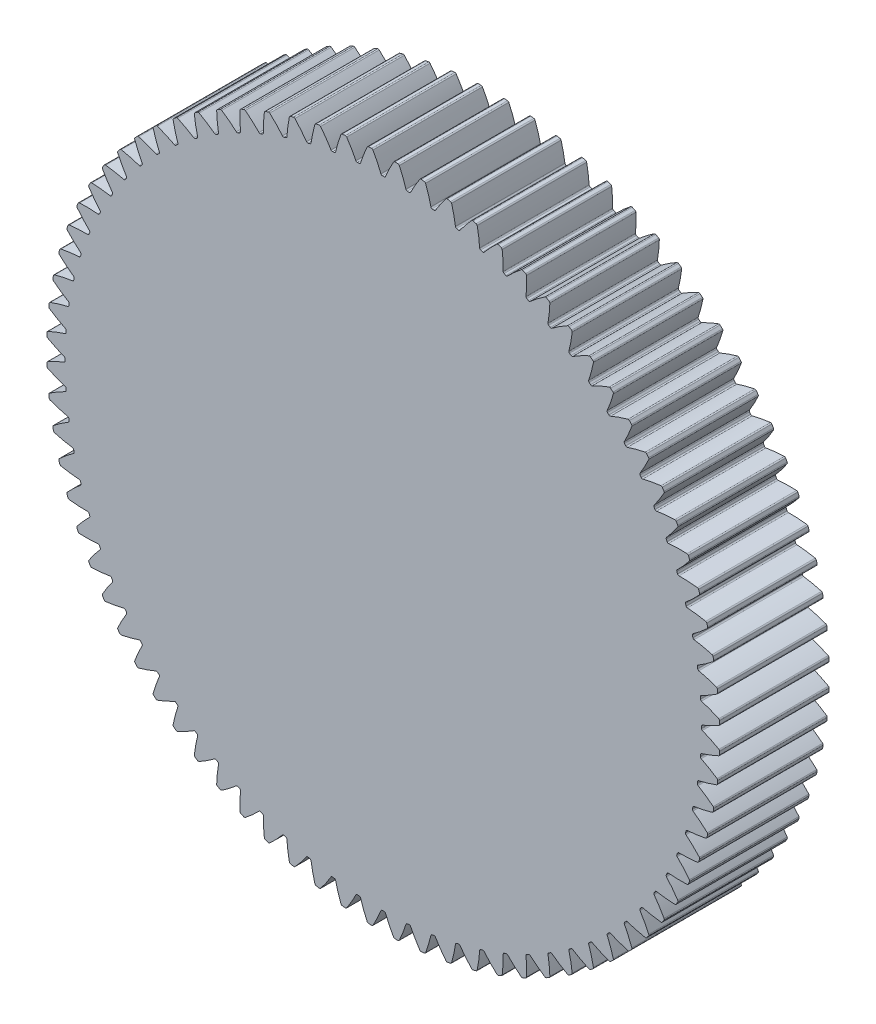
SolidWorks part; units mm, degrees
ref_plane "Front" through (0, 0, 0) normal (0, 0, 1) x (1, 0, 0)
ref_plane "Top" through (0, 0, 0) normal (0, 1, 0) x (1, 0, 0)
ref_plane "Right" through (0, 0, 0) normal (1, 0, 0) x (0, 0, -1)
sketch "Sketch1" plane through (0, 0, 0) normal (0, 0, 1) x (1, 0, 0)
  circle A0 centre (0, 0) radius 39.0525
extrude "Boss-Extrude1" add sketch "Sketch1" along normal blind 12.7
sketch "Sketch3" plane through (0, 0, 0) normal (0, 0, 1) x (1, 0, 0)
  line L0 (0, 0) -> (43.7181, 0) construction
  line L2 (0, 0) -> (0.3817, 36.9074) construction
  line L3 (0, 0) -> (-0.3817, 36.9074) construction
  line L4 (-0.3817, 36.9074) -> (-0.3571, 34.5285) construction
  line L5 (0, 0) -> (0, 61.276) construction
  line L6 (0.3817, 36.9074) -> (0.3571, 34.5285) construction
  circle A0 centre (0, 0) radius 39.0525 construction
  circle A1 centre (0, 0) radius 38.1 construction
  circle A2 centre (0, 0) radius 34.5303 construction
  arc A3 (-0.3817, 36.9074) -> (0.3817, 36.9074) centre (0, 0) ccw construction
  arc A5 (1.2465, 39.0326) -> (-1.2465, 39.0326) centre (0, 0) ccw
  spline S0 degree 4 poles (0.3571, 34.5285) (0.357, 34.5356) (0.3568, 34.5556) (0.3553, 34.5934) (0.3515, 34.655) (0.3447, 34.7335) (0.3335, 34.835) (0.3173, 34.9544) (0.2963, 35.0856) (0.2701, 35.2281) (0.241, 35.3702) (0.2092, 35.5118) (0.1749, 35.6526) (0.1305, 35.8231) (0.073, 36.0271) (-0.0001, 36.2652) (-0.0902, 36.5346) (-0.1896, 36.8084) (-0.2936, 37.0772) (-0.4059, 37.348) (-0.5196, 37.6095) (-0.645, 37.8802) (-0.7644, 38.1296) (-0.9064, 38.4079) (-1.0233, 38.6323) (-1.1861, 38.927) (-1.2848, 39.1007) (-1.4033, 39.3036) (-1.4575, 39.3934) (-1.4908, 39.4487) knots 0 0 0 0 0 0.005377 0.015084 0.028532 0.04661 0.064855 0.092111 0.119476 0.146842 0.174209 0.201575 0.228941 0.256307 0.307035 0.361767 0.4165 0.471232 0.525964 0.580697 0.635429 0.690161 0.744894 0.799626 0.854358 0.909091 0.954545 1 1 1 1 1 construction
  spline S1 degree 4 poles (0.3571, 34.5285) (0.357, 34.5356) (0.3568, 34.5556) (0.3553, 34.5934) (0.3515, 34.655) (0.3447, 34.7335) (0.3335, 34.835) (0.3173, 34.9544) (0.2963, 35.0856) (0.2701, 35.2281) (0.241, 35.3702) (0.2092, 35.5118) (0.1749, 35.6526) (0.1305, 35.8231) (0.073, 36.0271) (-0.0001, 36.2652) (-0.0902, 36.5346) (-0.1896, 36.8084) (-0.2936, 37.0772) (-0.4059, 37.348) (-0.5196, 37.6095) (-0.645, 37.8802) (-0.7644, 38.1296) (-0.9064, 38.4079) (-1.0233, 38.6323) (-1.1508, 38.8631) (-1.2139, 38.9753) (-1.2465, 39.0326) knots 0 0 0 0 0 0.005377 0.015084 0.028532 0.04661 0.064855 0.092111 0.119476 0.146842 0.174209 0.201575 0.228941 0.256307 0.307035 0.361767 0.4165 0.471232 0.525964 0.580697 0.635429 0.690161 0.744894 0.799626 0.854358 0.909091 0.909091 0.909091 0.909091 0.909091
  spline S2 degree 4 poles (-0.3571, 34.5285) (-0.357, 34.5356) (-0.3568, 34.5556) (-0.3553, 34.5934) (-0.3515, 34.655) (-0.3447, 34.7335) (-0.3335, 34.835) (-0.3173, 34.9544) (-0.2963, 35.0856) (-0.2701, 35.2281) (-0.241, 35.3702) (-0.2092, 35.5118) (-0.1749, 35.6526) (-0.1305, 35.8231) (-0.073, 36.0271) (0.0001, 36.2652) (0.0902, 36.5346) (0.1896, 36.8084) (0.2936, 37.0772) (0.4059, 37.348) (0.5196, 37.6095) (0.645, 37.8802) (0.7644, 38.1296) (0.9064, 38.4079) (1.0233, 38.6323) (1.1861, 38.927) (1.2848, 39.1007) (1.4033, 39.3036) (1.4575, 39.3934) (1.4908, 39.4487) knots 0 0 0 0 0 0.005377 0.015084 0.028532 0.04661 0.064855 0.092111 0.119476 0.146842 0.174209 0.201575 0.228941 0.256307 0.307035 0.361767 0.4165 0.471232 0.525964 0.580697 0.635429 0.690161 0.744894 0.799626 0.854358 0.909091 0.954545 1 1 1 1 1 construction
  spline S3 degree 4 poles (-0.3571, 34.5285) (-0.357, 34.5356) (-0.3568, 34.5556) (-0.3553, 34.5934) (-0.3515, 34.655) (-0.3447, 34.7335) (-0.3335, 34.835) (-0.3173, 34.9544) (-0.2963, 35.0856) (-0.2701, 35.2281) (-0.241, 35.3702) (-0.2092, 35.5118) (-0.1749, 35.6526) (-0.1305, 35.8231) (-0.073, 36.0271) (0.0001, 36.2652) (0.0902, 36.5346) (0.1896, 36.8084) (0.2936, 37.0772) (0.4059, 37.348) (0.5196, 37.6095) (0.645, 37.8802) (0.7644, 38.1296) (0.9064, 38.4079) (1.0233, 38.6323) (1.1508, 38.8631) (1.2139, 38.9753) (1.2465, 39.0326) knots 0 0 0 0 0 0.005377 0.015084 0.028532 0.04661 0.064855 0.092111 0.119476 0.146842 0.174209 0.201575 0.228941 0.256307 0.307035 0.361767 0.4165 0.471232 0.525964 0.580697 0.635429 0.690161 0.744894 0.799626 0.854358 0.909091 0.909091 0.909091 0.909091 0.909091
  point P0 (0, -36.9094)
sketch "DCLTBC" [suppressed] plane through (0, 0, 0) normal (0, 0, 1) x (1, 0, 0)
  line L0 (0, 0) -> (41.04, 0) construction
  line L1 (-16.5988, 341.5199) -> (-17.1927, 353.7396) construction
  line L2 (16.5988, 341.5199) -> (17.1927, 353.7396) construction
  line L3 (-16.5988, 341.5199) -> (-17.1927, 353.7396)
  line L4 (16.5988, 341.5199) -> (17.1927, 353.7396)
  line L5 (0, 0) -> (0, 104.9356) construction
  circle A0 centre (0, 0) radius 429.8462
  circle A1 centre (0, 0) radius 390.7692 construction
  circle A2 centre (0, 0) radius 354.1572 construction
  arc A3 (16.5988, 341.5199) -> (-16.5988, 341.5199) centre (0, 0) ccw construction
  arc A4 (16.5988, 341.5199) -> (-16.5988, 341.5199) centre (0, 0) ccw
  spline S0 degree 4 poles (-1014.6631, 283.0439) (-47.6852, 335.8844) (-17.293, 343.3327) (-16.5403, 349.5311) (-17.4538, 355.9262) (-17.693, 357.2758) (-18.0546, 359.0133) (-18.5477, 361.0502) (-19.1599, 363.2771) (-19.9008, 365.6854) (-20.7071, 368.0753) (-21.5719, 370.4445) (-22.4903, 372.7935) (-23.665, 375.6195) (-25.1689, 378.9903) (-27.0474, 382.8826) (-29.347, 387.2688) (-31.8293, 391.6605) (-34.4404, 395.9766) (-36.8296, 399.688) (-38.9472, 402.8229) (-40.7561, 405.4047) (-42.229, 407.452) (-44.1012, 409.9882) (-46.0141, 412.4944) (-47.9652, 414.9702) (-49.954, 417.4168) (-51.5659, 419.3552) (-52.9965, 421.0377) (-54.2324, 422.4653) (-55.2776, 423.6552) (-58.4723, 427.2561) (-63.5875, 432.7944) (-33.3353, 399.1791) (-729.2796, 1166.5662) knots -0.233759 -0.233759 -0.233759 -0.233759 -0.233759 0.005377 0.015084 0.028532 0.04661 0.064855 0.092111 0.119476 0.146842 0.174209 0.201575 0.228941 0.256307 0.307035 0.361767 0.4165 0.471232 0.525964 0.580697 0.608063 0.635429 0.662795 0.690161 0.744894 0.77226 0.799626 0.826992 0.854358 0.868042 0.881725 0.895408 1.068789 1.068789 1.068789 1.068789 1.068789 only from (-17.1927, 353.7396) to (-57.3769, 425.9995) construction
  spline S1 degree 4 poles (1014.6631, 283.0439) (47.6852, 335.8844) (17.293, 343.3327) (16.5403, 349.5311) (17.4538, 355.9262) (17.693, 357.2758) (18.0546, 359.0133) (18.5477, 361.0502) (19.1599, 363.2771) (19.9008, 365.6854) (20.7071, 368.0753) (21.5719, 370.4445) (22.4903, 372.7935) (23.665, 375.6195) (25.1689, 378.9903) (27.0474, 382.8826) (29.347, 387.2688) (31.8293, 391.6605) (34.4404, 395.9766) (36.8296, 399.688) (38.9472, 402.8229) (40.7561, 405.4047) (42.229, 407.452) (44.1012, 409.9882) (46.0141, 412.4944) (47.9652, 414.9702) (49.954, 417.4168) (51.5659, 419.3552) (52.9965, 421.0377) (54.2324, 422.4653) (55.2776, 423.6552) (58.4723, 427.2561) (63.5875, 432.7944) (33.3353, 399.1791) (729.2796, 1166.5662) knots -0.233759 -0.233759 -0.233759 -0.233759 -0.233759 0.005377 0.015084 0.028532 0.04661 0.064855 0.092111 0.119476 0.146842 0.174209 0.201575 0.228941 0.256307 0.307035 0.361767 0.4165 0.471232 0.525964 0.580697 0.608063 0.635429 0.662795 0.690161 0.744894 0.77226 0.799626 0.826992 0.854358 0.868042 0.881725 0.895408 1.068789 1.068789 1.068789 1.068789 1.068789 only from (17.1927, 353.7396) to (57.3769, 425.9995) construction
  spline S2 degree 4 poles (-17.1927, 353.7396) (-17.2005, 353.8633) (-17.228, 354.2097) (-17.302, 354.863) (-17.4538, 355.9262) (-17.693, 357.2758) (-18.0546, 359.0133) (-18.5477, 361.0502) (-19.1599, 363.2771) (-19.9008, 365.6854) (-20.7071, 368.0753) (-21.5719, 370.4445) (-22.4903, 372.7935) (-23.665, 375.6195) (-25.1689, 378.9903) (-27.0474, 382.8826) (-29.347, 387.2688) (-31.8293, 391.6605) (-34.4404, 395.9766) (-36.8296, 399.688) (-38.9472, 402.8229) (-40.7561, 405.4047) (-42.229, 407.452) (-44.1012, 409.9882) (-46.0141, 412.4944) (-47.9652, 414.9702) (-49.954, 417.4168) (-51.5659, 419.3552) (-52.9965, 421.0377) (-54.2324, 422.4653) (-55.2776, 423.6552) (-56.0931, 424.5743) (-56.7935, 425.3543) (-57.1845, 425.7872) (-57.3769, 425.9995) knots 0 0 0 0 0 0.005377 0.015084 0.028532 0.04661 0.064855 0.092111 0.119476 0.146842 0.174209 0.201575 0.228941 0.256307 0.307035 0.361767 0.4165 0.471232 0.525964 0.580697 0.608063 0.635429 0.662795 0.690161 0.744894 0.77226 0.799626 0.826992 0.854358 0.868042 0.881725 0.895408 0.909091 0.909091 0.909091 0.909091 0.909091
  spline S3 degree 4 poles (17.1927, 353.7396) (17.2005, 353.8633) (17.228, 354.2097) (17.302, 354.863) (17.4538, 355.9262) (17.693, 357.2758) (18.0546, 359.0133) (18.5477, 361.0502) (19.1599, 363.2771) (19.9008, 365.6854) (20.7071, 368.0753) (21.5719, 370.4445) (22.4903, 372.7935) (23.665, 375.6195) (25.1689, 378.9903) (27.0474, 382.8826) (29.347, 387.2688) (31.8293, 391.6605) (34.4404, 395.9766) (36.8296, 399.688) (38.9472, 402.8229) (40.7561, 405.4047) (42.229, 407.452) (44.1012, 409.9882) (46.0141, 412.4944) (47.9652, 414.9702) (49.954, 417.4168) (51.5659, 419.3552) (52.9965, 421.0377) (54.2324, 422.4653) (55.2776, 423.6552) (56.0931, 424.5743) (56.7935, 425.3543) (57.1845, 425.7872) (57.3769, 425.9995) knots 0 0 0 0 0 0.005377 0.015084 0.028532 0.04661 0.064855 0.092111 0.119476 0.146842 0.174209 0.201575 0.228941 0.256307 0.307035 0.361767 0.4165 0.471232 0.525964 0.580697 0.608063 0.635429 0.662795 0.690161 0.744894 0.77226 0.799626 0.826992 0.854358 0.868042 0.881725 0.895408 0.909091 0.909091 0.909091 0.909091 0.909091
extrude "Cut-Extrude-DCLTBC" [suppressed] cut sketch "DCLTBC" along normal through all
fillet "Fillet-Tip-DCLTBC" [suppressed] radius 0.1694
fillet "Fillet-Root-DCLTBC" [suppressed] radius 0.3388
pattern_circular "CirPattern-DCLTBC" [suppressed] count 80 over 360
sketch "DCGTBC" plane through (0, 0, 0) normal (0, 0, 1) x (1, 0, 0)
  line L0 (0, 0) -> (41.04, 0) construction
  line L1 (-36.7689, 3.2169) -> (0, 0) construction
  line L2 (0, 0) -> (36.7689, 3.2169) construction
  line L3 (0, 0) -> (-16.5124, 0)
  line L5 (0, 0) -> (0, 104.9356) construction
  circle A0 centre (0, 0) radius 39.0525
  circle A1 centre (0, 0) radius 38.1 construction
  circle A2 centre (0, 0) radius 34.5303 construction
  arc A3 (-0.3817, 36.9074) -> (0.3817, 36.9074) centre (0, 0) ccw construction
  arc A11 (36.7689, 3.2169) -> (-36.7689, 3.2169) centre (0, 0) ccw
  spline S4 degree 4 poles (999.5283, 21.3837) (13.3575, 32.5788) (-0.1231, 33.1442) (-0.3981, 33.8968) (-0.3515, 34.655) (-0.3447, 34.7335) (-0.3335, 34.835) (-0.3173, 34.9544) (-0.2963, 35.0856) (-0.2701, 35.2281) (-0.241, 35.3702) (-0.2092, 35.5118) (-0.1749, 35.6526) (-0.1305, 35.8231) (-0.073, 36.0271) (0.0001, 36.2652) (0.0902, 36.5346) (0.1896, 36.8084) (0.2936, 37.0772) (0.4059, 37.348) (0.5196, 37.6095) (0.645, 37.8802) (0.7644, 38.1296) (0.9064, 38.4079) (1.4274, 39.4078) (3.172, 42.3196) (-13.7273, 12.3685) (496.6592, 907.6408) knots -0.526695 -0.526695 -0.526695 -0.526695 -0.526695 0.005377 0.015084 0.028532 0.04661 0.064855 0.092111 0.119476 0.146842 0.174209 0.201575 0.228941 0.256307 0.307035 0.361767 0.4165 0.471232 0.525964 0.580697 0.635429 0.690161 0.744894 0.799626 0.854358 1.665859 1.665859 1.665859 1.665859 1.665859 only from (-0.3571, 34.5285) to (1.2465, 39.0326) construction
  spline S5 degree 4 poles (-999.5283, 21.3837) (-13.3575, 32.5788) (0.1231, 33.1442) (0.3981, 33.8968) (0.3515, 34.655) (0.3447, 34.7335) (0.3335, 34.835) (0.3173, 34.9544) (0.2963, 35.0856) (0.2701, 35.2281) (0.241, 35.3702) (0.2092, 35.5118) (0.1749, 35.6526) (0.1305, 35.8231) (0.073, 36.0271) (-0.0001, 36.2652) (-0.0902, 36.5346) (-0.1896, 36.8084) (-0.2936, 37.0772) (-0.4059, 37.348) (-0.5196, 37.6095) (-0.645, 37.8802) (-0.7644, 38.1296) (-0.9064, 38.4079) (-1.4274, 39.4078) (-3.172, 42.3196) (13.7273, 12.3685) (-496.6592, 907.6408) knots -0.526695 -0.526695 -0.526695 -0.526695 -0.526695 0.005377 0.015084 0.028532 0.04661 0.064855 0.092111 0.119476 0.146842 0.174209 0.201575 0.228941 0.256307 0.307035 0.361767 0.4165 0.471232 0.525964 0.580697 0.635429 0.690161 0.744894 0.799626 0.854358 1.665859 1.665859 1.665859 1.665859 1.665859 only from (0.3571, 34.5285) to (-1.2465, 39.0326) construction
  spline S6 degree 4 poles (-0.3571, 34.5285) (-0.357, 34.5356) (-0.3568, 34.5556) (-0.3553, 34.5934) (-0.3515, 34.655) (-0.3447, 34.7335) (-0.3335, 34.835) (-0.3173, 34.9544) (-0.2963, 35.0856) (-0.2701, 35.2281) (-0.241, 35.3702) (-0.2092, 35.5118) (-0.1749, 35.6526) (-0.1305, 35.8231) (-0.073, 36.0271) (0.0001, 36.2652) (0.0902, 36.5346) (0.1896, 36.8084) (0.2936, 37.0772) (0.4059, 37.348) (0.5196, 37.6095) (0.645, 37.8802) (0.7644, 38.1296) (0.9064, 38.4079) (1.0233, 38.6323) (1.1508, 38.8631) (1.2139, 38.9753) (1.2465, 39.0326) knots 0 0 0 0 0 0.005377 0.015084 0.028532 0.04661 0.064855 0.092111 0.119476 0.146842 0.174209 0.201575 0.228941 0.256307 0.307035 0.361767 0.4165 0.471232 0.525964 0.580697 0.635429 0.690161 0.744894 0.799626 0.854358 0.909091 0.909091 0.909091 0.909091 0.909091
  spline S7 degree 4 poles (0.3571, 34.5285) (0.357, 34.5356) (0.3568, 34.5556) (0.3553, 34.5934) (0.3515, 34.655) (0.3447, 34.7335) (0.3335, 34.835) (0.3173, 34.9544) (0.2963, 35.0856) (0.2701, 35.2281) (0.241, 35.3702) (0.2092, 35.5118) (0.1749, 35.6526) (0.1305, 35.8231) (0.073, 36.0271) (-0.0001, 36.2652) (-0.0902, 36.5346) (-0.1896, 36.8084) (-0.2936, 37.0772) (-0.4059, 37.348) (-0.5196, 37.6095) (-0.645, 37.8802) (-0.7644, 38.1296) (-0.9064, 38.4079) (-1.0233, 38.6323) (-1.1508, 38.8631) (-1.2139, 38.9753) (-1.2465, 39.0326) knots 0 0 0 0 0 0.005377 0.015084 0.028532 0.04661 0.064855 0.092111 0.119476 0.146842 0.174209 0.201575 0.228941 0.256307 0.307035 0.361767 0.4165 0.471232 0.525964 0.580697 0.635429 0.690161 0.744894 0.799626 0.854358 0.909091 0.909091 0.909091 0.909091 0.909091
  dimension "D1" = 5
  dimension "D2" = 5
extrude "Cut-Extrude-DCGTBC" cut sketch "DCGTBC" along normal through all
fillet "Fillet-Tip-DCGTBC" radius 0.1694 4 edges at (1.2465, 39.0326, 6.35) (-1.2465, 39.0326, 6.35) (0.229, 36.9087, 6.35) (-0.229, 36.9087, 6.35)
pattern_circular "CirPattern-DCGTBC" count 80 over 360 about axis through (0, 0, 12.7) along (0, 0, 1) of "Cut-Extrude-DCGTBC", "Fillet-Tip-DCGTBC"
sketch "Sketch4" plane through (0, 0, 12.7) normal (0, 0, 1) x (1, 0, 0)
  circle A1 centre (0, 0) radius 6.5
extrude "Cut-Extrude2" cut sketch "Sketch4" against normal through all
sketch "Sketch5" plane through (0, 0, 12.7) normal (0, 0, 1) x (1, 0, 0)
  circle A0 centre (-12.7, 0) radius 2.286
  circle A1 centre (0, 12.7) radius 2.286
  circle A2 centre (12.7, 0) radius 2.286
  circle A3 centre (0, -12.7) radius 2.286
  point P12 (0, 0)
  dimension "D2" = 4.572
  dimension "D1" = 12.7
  dimension "D3" = 4
extrude "Cut-Extrude3" cut sketch "Sketch5" against normal through all
equation "\"DiametralPitch\" = 80 / 3'Diametral Pitch"
equation "\"NumTeeth\" = 80'Number of Teeth"
equation "\"PressureAngle\"= 25deg'Pressure Angle"
equation "\"Addendum\"= 1 / \"DiametralPitch\"'Addendum"
equation "\"Dedendum\"= 1.25 / \"DiametralPitch\"'Dedendum"
equation "\"WorkingDepth\"= 2 / \"DiametralPitch\"'Working Depth - here for REF (Not used in building model)"
equation "\"WholeDepth\"= 2.25 / \"DiametralPitch\"'Whole Depth - here for REF (Not used in building model)"
equation "\"Clearance\"= .25 / \"DiametralPitch\"'Clearance"
equation "\"CircularPitch\"= pi / \"DiametralPitch\"'Circular Pitch - here for REF (Not used in building model)"
equation "\"PitchCircle\"= \"NumTeeth\" / \"DiametralPitch\"'Pitch Circle - or - Pitch Diameter"
equation "\"OutsideDiameter\"= ( \"NumTeeth\" + 2 ) / \"DiametralPitch\"'Outside Diameter"
equation "\"Fillet_Root\"= \"Clearance\" * cos ( \"PressureAngle\" ) * tan ( ( 90 + \"PressureAngle\" ) / 2 ) 'Fillet Root"
equation "\"AddendumCircle\"= \"PitchCircle\" + ( 2 * \"Addendum\" )'Addendum Circle - or - Addendum Diameter"
equation "\"DedendumCircle\"= \"PitchCircle\" - ( 2 * \"Dedendum\" )'Dedendum Circle - or - Dedendum Diameter"
equation "\"BaseCircle\"= \"PitchCircle\" * cos ( \"PressureAngle\" )'Base Circle - Base Diameter"
equation "\"PitchAngle\"= 360deg / \"NumTeeth\"'Pitch Angle"
equation "\"Alpha\"= sqr ( \"PitchCircle\" ^ 2 - \"BaseCircle\" ^ 2 ) / \"BaseCircle\" * 180 / PI - \"PressureAngle\"'Alpha - Used for Calculating Beta"
equation "\"Beta\"= ( \"PitchAngle\" / 4 - ( \"Alpha\" - 90 ) )'Beta - Used in definition of the parameters for the parametric equation driven curve"
equation "\"Gamma\"= ( \"PitchAngle\" / 4 - ( \"Alpha\" + 90 ) )'Gamma - Used in definition of the parameters for the parametric equation driven curve"
equation "\"Phi\"= sqr ( ( \"AddendumCircle\" / 2 ) ^ 2 - ( \"BaseCircle\" / 2 ) ^ 2 ) / ( \"BaseCircle\" / 2 )'Phi - Used in definition of the parameters for the parametric equation driven curve"
equation "\"DCGTBC\"= iif ( \"DedendumCircle\" > \"BaseCircle\" , \"unsuppressed\" , \"suppressed\" )'if Dedendum Circle IS GREATER THAN BaseCircle THEN UnsuppressORSuppress FEATURE"
equation "\"DCLTBC\"= iif ( \"DedendumCircle\" - .002 > \"BaseCircle\" , \"suppressed\" , \"unsuppressed\" )'if Dedendum Circle - .002 IS GREATER THAN BaseCircle THEN SuppressORUnsuppress FEATURE"
equation "\"Cut-Extrude-DCGTBC\"= iif ( \"DedendumCircle\" > \"BaseCircle\" , \"unsuppressed\" , \"suppressed\" )'if Dedendum Circle IS GREATER THAN BaseCircle THEN UnsuppressORSuppress FEATURE"
equation "\"Cut-Extrude-DCLTBC\"= iif ( \"DedendumCircle\" - .002 > \"BaseCircle\" , \"suppressed\" , \"unsuppressed\" )'if Dedendum Circle - .002 IS GREATER THAN BaseCircle THEN SuppressORUnsuppress FEATURE"
equation "\"CirPattern-DCGTBC\"= iif ( \"DedendumCircle\" > \"BaseCircle\" , \"unsuppressed\" , \"suppressed\" )'if Dedendum Circle IS GREATER THAN BaseCircle THEN UnsuppressORSuppress FEATURE"
equation "\"CirPattern-DCLTBC\"= iif ( \"DedendumCircle\" - .002 > \"BaseCircle\" , \"suppressed\" , \"unsuppressed\" )'if Dedendum Circle - .002 IS GREATER THAN BaseCircle THEN SuppressORUnsuppress FEATURE"
equation "\"Fillet-Tip-DCGTBC\"= iif ( \"DedendumCircle\" > \"BaseCircle\" , \"unsuppressed\" , \"suppressed\" )'if Dedendum Circle IS GREATER THAN BaseCircle THEN UnsuppressORSuppress FEATURE"
equation "\"Fillet-Tip-DCLTBC\"= iif ( \"DedendumCircle\" - .002 > \"BaseCircle\" , \"suppressed\" , \"unsuppressed\" )'if Dedendum Circle - .002 IS GREATER THAN BaseCircle THEN SuppressORUnsuppress FEATURE"
equation "\"Fillet-Root-DCLTBC\"= iif ( \"DedendumCircle\" - .002 > \"BaseCircle\" , \"suppressed\" , \"unsuppressed\" )'if Dedendum Circle - .002 IS GREATER THAN BaseCircle THEN SuppressORUnsuppress FEATURE"
equation "\"D1@CirPattern-DCGTBC\"= \"NumTeeth\"'Number of Teeth"
equation "\"D1@CirPattern-DCLTBC\"= \"NumTeeth\"'Number of Teeth"
equation "\"D1@Fillet-Tip-DCGTBC\"= \"Fillet_Root\" / 2 'Tip Rad For Large No of Teeth"
equation "\"D1@Fillet-Tip-DCLTBC\"=\"Fillet_Root\" / 2'Tip Rad For Small No of Teeth"
equation "\"D1@Fillet-Root-DCLTBC\"= \"Fillet_Root\"'Fillet Root"
